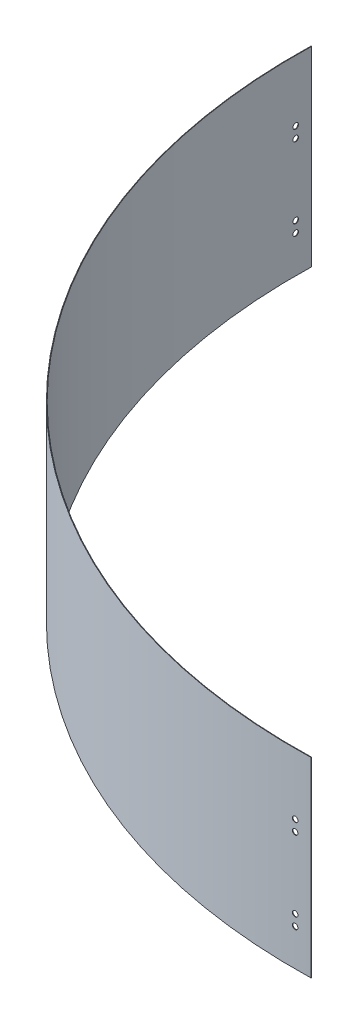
SolidWorks part; units mm, degrees
ref_plane "Front Plane" through (0, 0, 0) normal (0, 0, 1) x (1, 0, 0)
ref_plane "Top Plane" through (0, 0, 0) normal (0, 1, 0) x (1, 0, 0)
ref_plane "Right Plane" through (0, 0, 0) normal (1, 0, 0) x (0, 0, -1)
sketch "Sketch1" plane through (0, 0, 0) normal (0, 1, 0) x (1, 0, 0)
  circle A0 centre (0, 0) radius 220
  dimension "D1" = 440
extrude "Extrude-Thin1" add sketch "Sketch1" along normal blind 50 and the other way blind 20 thin
sketch "Sketch2" plane through (0, 0, 0) normal (0, 0, 1) x (1, 0, 0)
  line L0 (0, 0) -> (0, -25.0185) construction
  circle A0 centre (0, -2.45) radius 1
  circle A1 centre (0, -6.45) radius 1
  circle A4 centre (0, 27.55) radius 1
  circle A5 centre (0, 23.55) radius 1
  dimension "D1" = 2
  dimension "D4" = 2
  dimension "D5" = 2
  dimension "D2" = 4
  dimension "D3" = 2.45
  dimension "D6" = 4
  dimension "D7" = 26
extrude "Cut-Extrude1" cut sketch "Sketch2" against normal through all and the other way through all
pattern_circular "CirPattern1" count 4 over 360 about axis through (0, -20, 0) along (0, 1, 0) of "Cut-Extrude1"
sketch "Sketch3" plane through (0, 0, 0) normal (0, 1, 0) x (1, 0, 0)
  line L0 (0, 0) -> (-294.9479, 7.7235)
  line L1 (-294.9479, 7.7235) -> (-294.9479, 295.5043)
  line L2 (-294.9479, 295.5043) -> (297.065, 295.5043)
  line L3 (297.065, 295.5043) -> (297.065, -375.26)
  line L4 (297.065, -375.26) -> (9.8265, -375.26)
  line L5 (9.8265, -375.26) -> (0, 0)
  line L6 (0, 0) -> (0, -580.3282) construction
  line L7 (0, 0) -> (-492.5587, 0) construction
  dimension "D1" = 1.5
  dimension "D2" = 1.5
extrude "Cut-Extrude2" cut sketch "Sketch3" against normal through all both and the other way through all
surface "Surface-Flatten1" [suppressed]
sketch "Sketch4" plane through (0, 0, 0) normal (0, 1, 0) x (1, 0, 0)
  line L0 (0, 0) -> (-245.3938, -245.3938)
  line L1 (-245.3938, -245.3938) -> (-245.3938, 48.5916)
  line L2 (-245.3938, 48.5916) -> (0, 0)
  line L3 (0, 0) -> (-138.7097, 0) construction
  dimension "D1" = 45
sketch "Sketch5" plane through (0, 0, 0) normal (0, 1, 0) x (1, 0, 0)
  line L0 (0, 0) -> (-242.7681, -242.7681)
  line L1 (-242.7681, -242.7681) -> (24.431, -242.7681)
  line L2 (24.431, -242.7681) -> (0, 0)
  line L3 (0, 0) -> (0, -356.8439) construction
  dimension "D1" = 45
